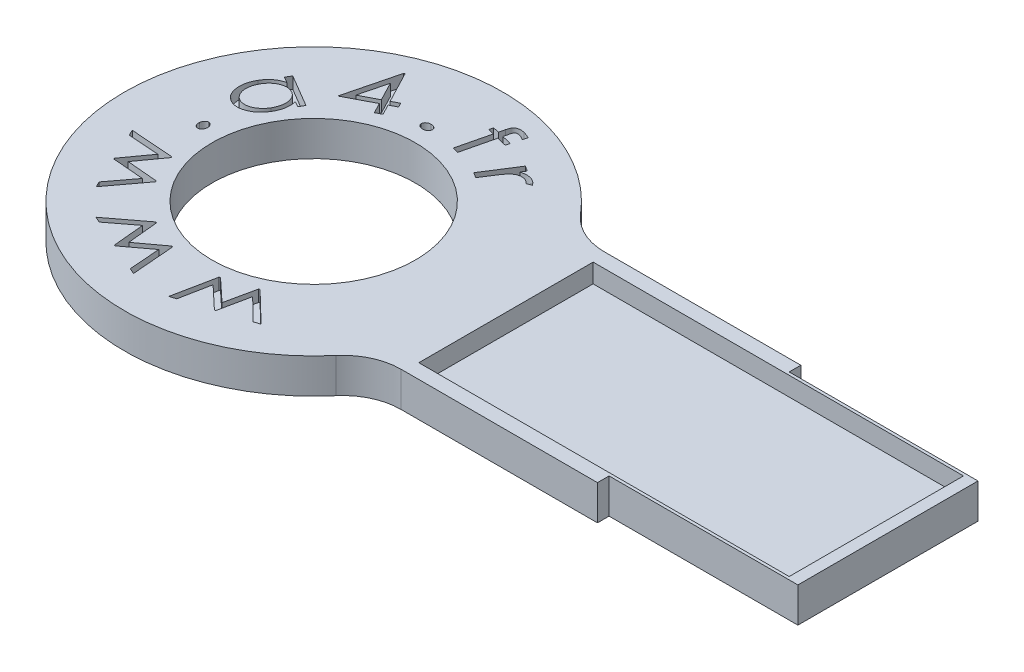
SolidWorks part; units mm, degrees
ref_plane "Plan de face" through (0, 0, 0) normal (0, 0, 1) x (1, 0, 0)
ref_plane "Plan de dessus" through (0, 0, 0) normal (0, 1, 0) x (1, 0, 0)
ref_plane "Plan de droite" through (0, 0, 0) normal (1, 0, 0) x (0, 0, -1)
sketch "Esquisse1" plane through (0, 0, 0) normal (0, 1, 0) x (1, 0, 0)
  line L0 (-65.3221, 0) -> (85.4006, 0) construction
  line L1 (0, 35.8736) -> (0, -40.6924) construction
  line L2 (-1.5, 11.7069) -> (-1.5, -9.2007) construction
  line L3 (-25, 6.2) -> (25, 6.2) construction
  line L4 (-25, 6.2) -> (-25, -6.2) construction
  line L5 (-25, -6.2) -> (25, -6.2) construction
  line L6 (25, 6.2) -> (25, -6.2)
  line L7 (-25, 6.2) -> (25, -6.2) construction
  line L8 (-25, -6.2) -> (25, 6.2) construction
  line L9 (12, 6.2) -> (12, 7)
  line L10 (12, -6.2) -> (25, -6.2)
  line L11 (12, 6.2) -> (25, 6.2)
  line L12 (-3.5385, -7) -> (12, -7)
  line L14 (-3.5385, 7) -> (12, 7)
  line L15 (12, -7) -> (12, -6.2)
  line L16 (-19.5995, -7) -> (12, 7) construction
  line L17 (-19.5995, 7) -> (12, -7) construction
  arc A0 (-3.5385, 7) -> (-3.5385, -7) centre (-14.5381, 0) ccw
  point P5 (0, 0)
  point P14 (-3.7998, 0)
  dimension "D4" = 13
  dimension "D1" = 12.4
  dimension "D2" = 50
  dimension "D3" = 1.5
  dimension "D5" = 14
extrude "Boss.-Extru.1" add sketch "Esquisse1" against normal blind 2.4
sketch "Esquisse2" plane through (0, 0, 0) normal (0, 1, 0) x (1, 0, 0)
  line L1 (-1.3, 6) -> (24.2, 6)
  line L2 (-1.3, 6) -> (-1.3, -6)
  line L3 (-1.3, -6) -> (24.2, -6)
  line L4 (24.2, 6) -> (24.2, -6)
  line L6 (25, -6.2) -> (25, 6.2) construction
  line L7 (0, 0) -> (0, 9.6803) construction
  line L8 (-2.3, 10.2545) -> (-2.3, -8.4238) construction
  line L9 (12, -6.2) -> (25, -6.2) construction
  line L10 (25, 6.2) -> (-3.0685, 6.2) construction
  dimension "D1" = 12
  dimension "D2" = 0.2
  dimension "D3" = 0.2
  dimension "D4" = 0.8
  dimension "D5" = 25.5
  dimension "D6" = 1
  dimension "D7" = 2.3
extrude "Enlèv. mat.-Extru.1" cut sketch "Esquisse2" against normal blind 1.3
sketch "Esquisse3" plane through (0, 0, 0) normal (0, 1, 0) x (1, 0, 0)
  circle A0 centre (-14.5381, 0) radius 7
extrude "Enlèv. mat.-Extru.2" cut sketch "Esquisse3" against normal through all
sketch "Esquisse4" plane through (0, 0, 0) normal (0, 1, 0) x (1, 0, 0)
  circle A0 centre (-14.5381, 0) radius 8.195 construction
  text T0 "www.a4.fr   " font "Century Gothic" height 3.5
extrude "Enlèv. mat.-Extru.3" cut sketch "Esquisse4" against normal blind 0.8
fillet "Congé1" radius 4 2 edges at (-3.5385, -1.2, 7) (-3.5385, -1.2, -7)
